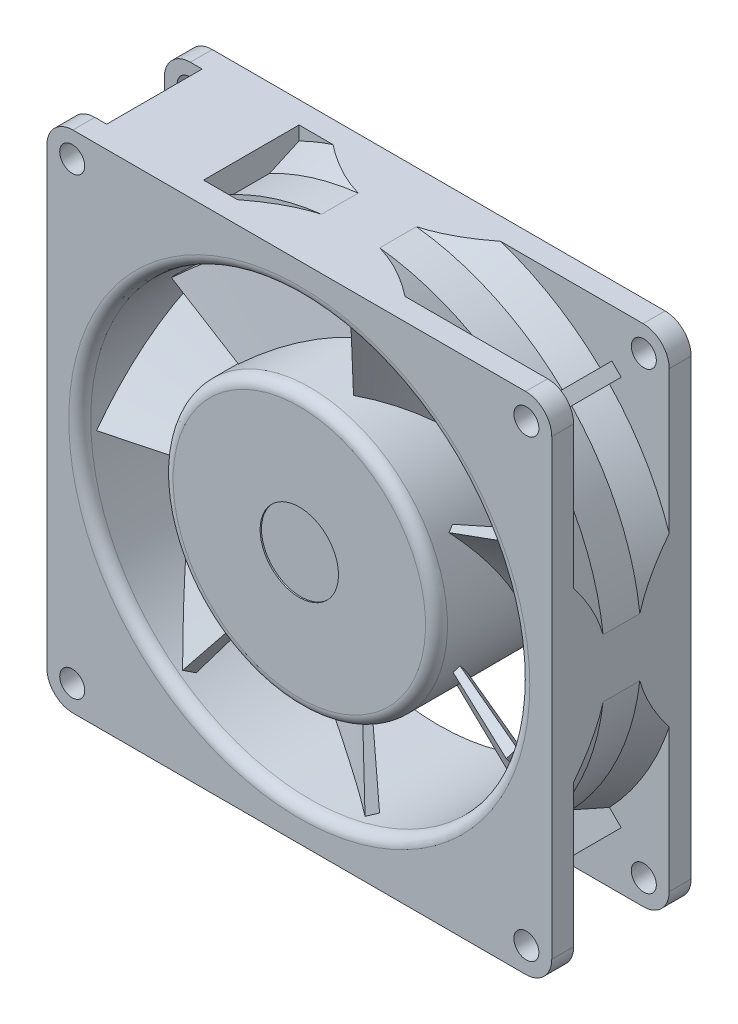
SolidWorks part; units mm, degrees
ref_plane "Front Plane" through (0, 0, 0) normal (0, 0, 1) x (1, 0, 0)
ref_plane "Top Plane" through (0, 0, 0) normal (0, 1, 0) x (1, 0, 0)
ref_plane "Right Plane" through (0, 0, 0) normal (1, 0, 0) x (0, 0, -1)
imported_body "Imported2"
imported_body "Imported3"
other "Move Face1" parameters "D1"=0.127
other "Move Face2" parameters "D1"=0.127
other "Move Face3" parameters "D1"=0.127
other "Move Face4" parameters "D1"=0.127
other "Move Face5" parameters "D1"=0.127
sketch "Sketch1" plane through (0, 0, 25.4) normal (0, 0, 1) x (1, 0, 0)
  line L0 (-41.377, -41.377) -> (-41.377, 41.377) construction
  line L1 (41.377, 41.377) -> (-41.377, 41.377) construction
  circle A0 centre (-41.377, 41.377) radius 2.2771
  dimension "D1" = 4.5542
extrude "Cut-Extrude1" cut sketch "Sketch1" against normal through all
